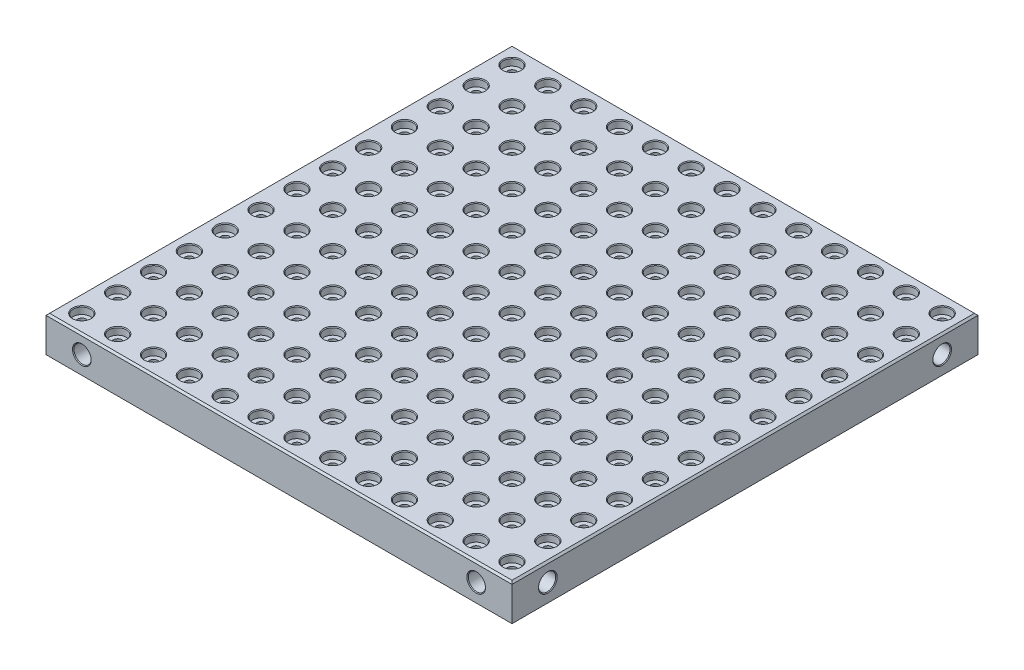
SolidWorks part; units mm, degrees
extrude "Base-Extrusion" add sketch "Esquisse1" along normal blind 25
sketch "Esquisse1" plane through (0, 0, 0) normal (0, 1, 0) x (1, 0, 0)
  line L1 (-162.5, -162.5) -> (162.5, -162.5)
  line L2 (-162.5, -162.5) -> (-162.5, 162.5)
  line L3 (-162.5, 162.5) -> (162.5, 162.5)
  line L4 (162.5, -162.5) -> (162.5, 162.5)
ref_plane "Plan1" through (0, 0, 0) normal (0, 0, 1) x (1, 0, 0)
ref_plane "Plan2" through (0, 0, 0) normal (0, 1, 0) x (1, 0, 0)
ref_plane "Plan3" through (0, 0, 0) normal (1, 0, 0) x (0, 0, -1)
chamfer "Chanfrein1" distance 1.25 angle 45
ref_plane "Plan4" through (0, 25, 0) normal (0, 1, 0) x (-1, 0, 0)
hole_wizard "Perçage1" positions "Esquisse4" profile "Esquisse3" legacy
sketch "Esquisse4" plane through (0, 25, 0) normal (0, 1, 0) x (-1, 0, 0)
  point P0 (-150, 150)
sketch "Esquisse3" plane through (150, 25, 150) normal (1, 0, 0) x (0, 0, 1)
  line L0 (0, 0) -> (0, 25)
  line L1 (0, 25) -> (3, 25)
  line L2 (3, 25) -> (3, 5)
  line L3 (3, 5) -> (6, 5)
  line L4 (6, 5) -> (6, 0)
  line L5 (6, 0) -> (0, 0)
  line L6 (0, 110) -> (0, -10) construction
chamfer "Chanfrein2" distance 0.5 angle 45
pattern_linear "Répétition linéaire1"
hole_wizard "Perçage2" positions "Esquisse7" profile "Esquisse6" legacy
sketch "Esquisse7" plane through (162.5, 0, 0) normal (1, 0, 0) x (0, 0, -1)
  point P0 (-137.5, 12.5)
sketch "Esquisse6" plane through (162.5, 12.5, 137.5) normal (0, 1, 0) x (0, 0, -1)
  line L0 (0, 0) -> (0, 23.6052)
  line L1 (0, 23.6052) -> (6, 20)
  line L2 (6, 20) -> (6, 0)
  line L4 (6, 0) -> (0, 0)
  line L6 (0, 23.6052) -> (-6, 20) construction
  line L7 (0, -4.2442) -> (0, 117.3081) construction
chamfer "Chanfrein3" distance 0.5 angle 45
pattern_linear "Répétition linéaire2" count 2 spacing 275
mirror "Symétrie1" about plane through (0, 0, 0) normal (1, 0, 0)
hole_wizard "Perçage4" positions "Esquisse12" profile "Esquisse11" legacy
sketch "Esquisse12" plane through (0, 0, 162.5) normal (0, 0, 1) x (1, 0, 0)
  point P0 (-137.5, 12.5)
sketch "Esquisse11" plane through (-137.5, 12.5, 162.5) normal (1, 0, 0) x (0, -1, 0)
  line L0 (0, 0) -> (0, 23.6052)
  line L1 (0, 23.6052) -> (6, 20)
  line L2 (6, 20) -> (6, 0)
  line L4 (6, 0) -> (0, 0)
  line L6 (0, 23.6052) -> (-6, 20) construction
  line L7 (0, -4.2442) -> (0, 117.3081) construction
chamfer "Chanfrein4" distance 0.5 angle 45
pattern_linear "Répétition linéaire3" count 2 spacing 275
mirror "Symétrie2" about plane through (0, 0, 0) normal (0, 0, 1)
equation "\"D3@Esquisse1\" = \"D1@Esquisse1\"/2"
equation "\"D2@Esquisse1\" = \"D1@Esquisse1\""
equation "\"D4@Esquisse1\" = \"D3@Esquisse1\""
equation "\"D1@Esquisse7\" = \"L@Esquisse4\"+\"C@Répétition linéaire1\"/2"
equation "\"D2@Esquisse7\" = \"EP@Base-Extrusion\"/2"
equation "\"Diamètre@Esquisse6\" = \"Diamètre chambrage@Esquisse3\""
equation "\"Profondeur@Esquisse6\" = \"C@Répétition linéaire1\"-5"
equation "\"D3@Répétition linéaire2\" = \"D2@Esquisse1\"-\"D1@Esquisse7\"*2"
equation "\"D1@Chanfrein1\" = \"EP@Base-Extrusion\"/20"
equation "\"D2@Esquisse12\" = \"D2@Esquisse7\""
equation "\"D1@Esquisse12\" = \"D1@Esquisse7\""
equation "\"Profondeur@Esquisse11\" = \"Profondeur@Esquisse6\""
equation "\"Diamètre@Esquisse11\" = \"Diamètre@Esquisse6\""
equation "\"D3@Répétition linéaire3\" = \"D3@Répétition linéaire2\""
